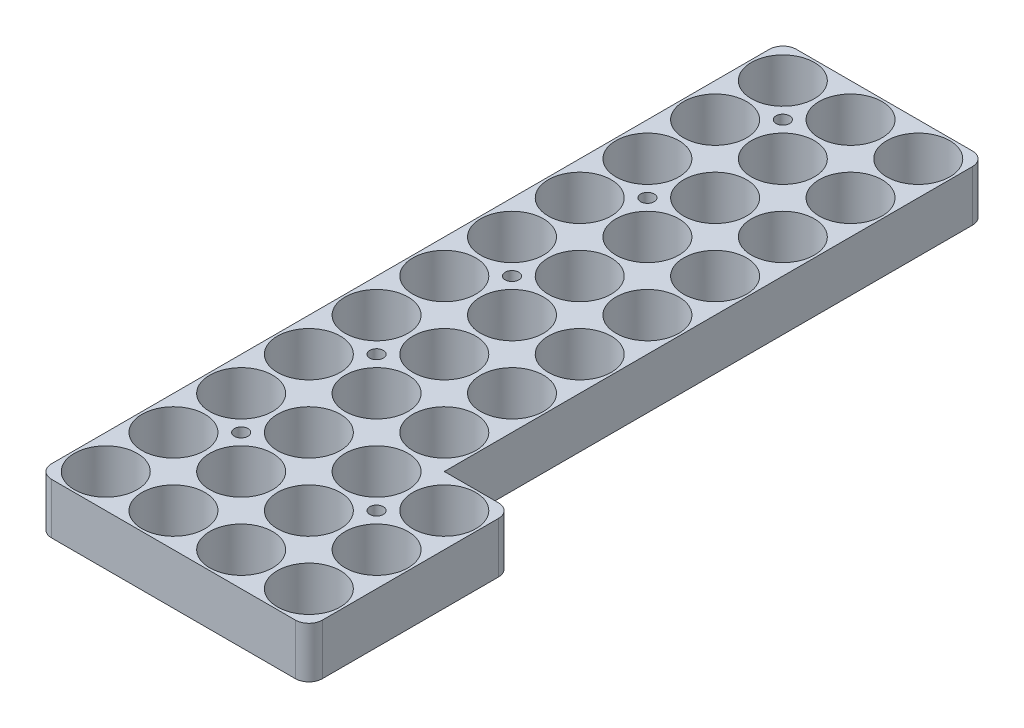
SolidWorks part; units mm, degrees
ref_plane "Plan de face" through (0, 0, 0) normal (0, 0, 1) x (1, 0, 0)
ref_plane "Plan de dessus" through (0, 0, 0) normal (0, 1, 0) x (1, 0, 0)
ref_plane "Plan de droite" through (0, 0, 0) normal (1, 0, 0) x (0, 0, -1)
sketch "Esquisse1" plane through (0, 0, 0) normal (0, 1, 0) x (1, 0, 0)
  line L0 (-50, 0) -> (50, 0) construction
  line L1 (50, 0) -> (50, 60) construction
  line L2 (50, 60) -> (30, 60) construction
  line L3 (30, 60) -> (30, 220)
  line L4 (30, 220) -> (-30, 220)
  line L5 (-30, 220) -> (-30, 60)
  line L6 (-30, 60) -> (-50, 60)
  line L7 (-50, 60) -> (-50, 0)
  line L8 (30, 60) -> (30, 0)
  line L9 (30, 0) -> (-50, 0)
  dimension "D1" = 20
  dimension "D2" = 60
  dimension "D3" = 220
  dimension "D4" = 60
extrude "Boss.-Extru.1" add sketch "Esquisse1" along normal blind 15
sketch "Esquisse2" plane through (0, 15, 0) normal (0, 1, 0) x (1, 0, 0)
  line L0 (-50, 60) -> (-50, 0) construction
  line L2 (-50, 0) -> (30, 0) construction
  circle A0 centre (-40, 10) radius 9.3
  dimension "D3" = 18.6
  dimension "D1" = 10
  dimension "D2" = 10
extrude "Enlèv. mat.-Extru.1" cut sketch "Esquisse2" against normal offset from surface (13.5 mm away) 1.5
pattern_linear "Répétition linéaire1" count 11 spacing 20 along (0, 0, -1) count 6 spacing 20 along (1, 0, 0) of "Enlèv. mat.-Extru.1"
sketch "Esquisse3" plane through (0, 15, 0) normal (0, 1, 0) x (1, 0, 0)
  line L2 (-40, 50) -> (-20, 30) construction
  circle A0 centre (-30, 40) radius 2
  circle A1 centre (-40, 50) radius 9.3 construction
  circle A3 centre (-20, 30) radius 9.3 construction
  dimension "D1" = 4
extrude "Enlèv. mat.-Extru.2" cut sketch "Esquisse3" against normal through all
pattern_linear "Répétition linéaire2" count 2 spacing 40 along (1, 0, 0) of "Enlèv. mat.-Extru.2"
pattern_linear "Répétition linéaire3" count 5 spacing 40 along (0, 0, -1) of "Répétition linéaire2"
sketch "Esquisse6" plane through (0, 0, 0) normal (0, -1, 0) x (1, 0, 0)
  line L0 (-29, -5) -> (-29, -15)
  line L1 (-29, -5) -> (29, -5)
  line L2 (-29, -15) -> (29, -15)
  line L3 (29, -5) -> (29, -15)
  line L4 (30, 0) -> (30, -220) construction
  line L5 (0, 0) -> (0, -5) construction
  line L6 (-50, 0) -> (30, 0) construction
  point P9 (-29, -10)
  dimension "D1" = 10
  dimension "D2" = 1
  dimension "D3" = 10
extrude "Enlèv. mat.-Extru.5" cut sketch "Esquisse6" against normal up to surface (1.5 mm away) contours L1 L3 L2 L0
pattern_linear "Répétition linéaire6" count 11 spacing 20 along (0, 0, -1) of "Enlèv. mat.-Extru.5"
sketch "Esquisse7" plane through (0, 0, 0) normal (0, -1, 0) x (1, 0, 0)
  line L0 (-45, -1) -> (-45, -59)
  line L1 (-45, -1) -> (-35, -1)
  line L2 (-45, -59) -> (-35, -59)
  line L3 (-35, -1) -> (-35, -59)
  line L4 (-29, -15) -> (29, -15) construction
  line L5 (-29, -5) -> (-29, -15) construction
  line L6 (-50, -60) -> (-50, 0) construction
  line L7 (-30, -60) -> (-50, -60) construction
  point P8 (-40, -59)
  dimension "D1" = 10
  dimension "D2" = 1
extrude "Enlèv. mat.-Extru.6" cut sketch "Esquisse7" against normal up to surface (1.5 mm away)
move or copy body "Corps-Déplacer/Copier1" bodies to move or copy 110
sketch "Esquisse8" plane through (0, 0, 0) normal (0, -1, 0) x (1, 0, 0)
  line L0 (-27.8046, -15) -> (-25, -17.8416)
  line L1 (-25, -17.8416) -> (-25, -22.1584)
  line L2 (-25, -22.1584) -> (-27.8046, -25)
  line L3 (-27.8046, -25) -> (-12.1584, -25)
  line L4 (-12.1584, -25) -> (-15, -22.1584)
  line L5 (-15, -22.1584) -> (-15, -17.8416)
  line L6 (-15, -17.8416) -> (-12.1584, -15)
  line L7 (-25, -20) -> (-15, -20) construction
  line L8 (-29, -5) -> (-29, -15) construction
  line L9 (-27.8046, -15) -> (-12.1584, -15)
  line L10 (29, -15) -> (-29, -15) construction
  arc A0 (-12.1584, -15) -> (-12.1584, -5) centre (-20, -10) ccw construction
  arc A1 (-29, -32.3431) -> (-27.8416, -35) centre (-20, -30) ccw construction
  point P23 (-37.8416, -15)
  point P24 (-27.8046, -15)
  point P30 (-27.8046, -25)
extrude "Enlèv. mat.-Extru.7" cut sketch "Esquisse8" against normal up to surface (1.5 mm away)
pattern_linear "Répétition linéaire7" count 5 spacing 40 along (0, 0, -1) count 2 spacing 40 along (1, 0, 0) of "Enlèv. mat.-Extru.7"
fillet "Congé1" radius 4 5 edges at (-30, 7.5, 0) (-30, 7.5, -220) (30, 7.5, -220) (50, 7.5, -60) (50, 7.5, 0)
